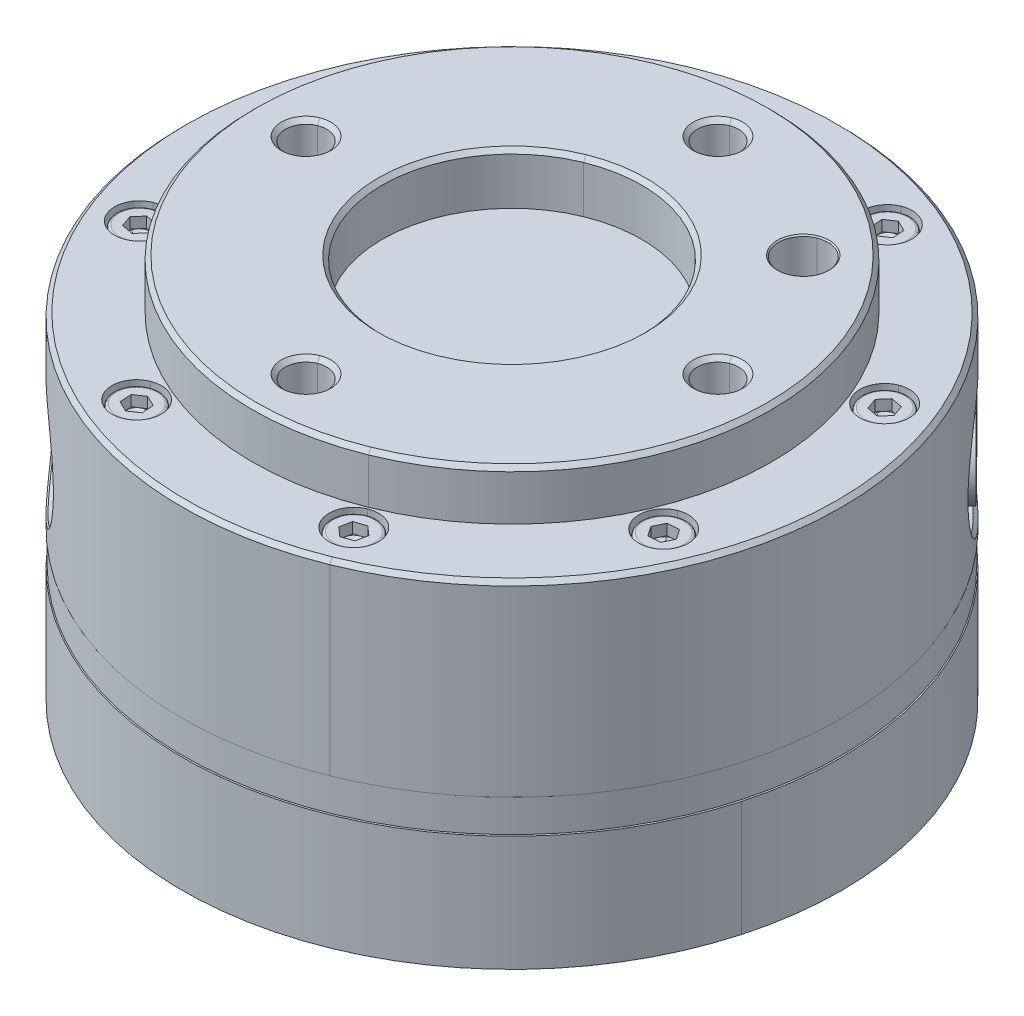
SolidWorks part; units mm, degrees
ref_plane "前视基准面" through (0, 0, 0) normal (0, 0, 1) x (1, 0, 0)
ref_plane "上视基准面" through (0, 0, 0) normal (0, 1, 0) x (1, 0, 0)
ref_plane "右视基准面" through (0, 0, 0) normal (1, 0, 0) x (0, 0, -1)
imported_body "输入1"
sketch "草图2" plane through (0, 0, 0) normal (0, 0, 1) x (1, 0, 0)
  line L0 (-31.9454, 13.1) -> (40, 13.1) construction
  line L1 (40, 13.1) -> (39.9, 13.1)
  line L2 (40, 13.1) -> (40, 17.1)
  line L3 (40, 17.1) -> (39.9, 17.1)
  line L4 (39.9, 13.1) -> (39.9, 17.1)
  line L5 (0, -25.19) -> (0, 25.19) construction
  dimension "D1" = 40
  dimension "D2" = 4
  dimension "D3" = 0.1
revolve "切除-旋转1" cut sketch "草图2" angle 360
other "移动面1" parameters "D1"=1
move or copy body "实体-移动/复制1" bodies to move or copy 114 copy no rotation origin (0.1997, 0, -0.5261) rotation axis (0, 1, 0) rotation angle 75
ref_plane "基准面1" through (0.2239, 0, 0.2278) normal (0.7009, 0, 0.7133) x (0.7133, 0, -0.7009)
other "删除面3"
